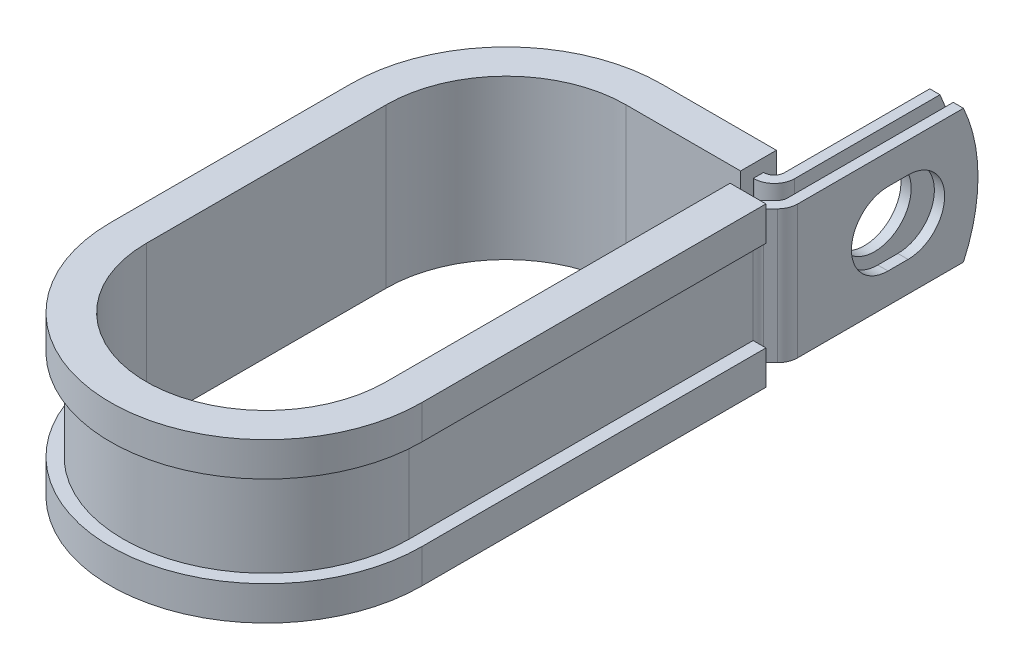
SolidWorks part; units mm, degrees
ref_plane "Front Plane" through (0, 0, 0) normal (0, 0, 1) x (1, 0, 0)
ref_plane "Top Plane" through (0, 0, 0) normal (0, 1, 0) x (1, 0, 0)
ref_plane "Right Plane" through (0, 0, 0) normal (1, 0, 0) x (0, 0, -1)
sketch "Sketch1" plane through (0, 0, 0) normal (0, 1, 0) x (1, 0, 0)
  line L0 (0, 15.8115) -> (13.6958, 15.8115)
  line L1 (15.8115, 0) -> (15.8115, 12.399)
  line L2 (16.1342, 37.2872) -> (16.1342, 18.2499)
  line L3 (16.5257, 14.1232) -> (17.3519, 14.9494)
  line L4 (-15.8115, 0) -> (-15.8115, -28.575)
  line L5 (17.709, 15.8115) -> (17.709, 37.2872)
  line L6 (15.8115, 0) -> (15.8115, -28.575)
  arc A0 (0, 15.8115) -> (-15.8115, 0) centre (0, 0) ccw
  arc A1 (16.5257, 14.1232) -> (15.8115, 12.399) centre (18.2499, 12.399) ccw
  arc A2 (17.3519, 14.9494) -> (17.709, 15.8115) centre (16.4898, 15.8115) ccw
  arc A3 (13.6958, 15.8115) -> (16.1342, 18.2499) centre (13.6958, 18.2499) ccw
  arc A4 (-15.8115, -28.575) -> (15.8115, -28.575) centre (0, -28.575) ccw
extrude "Extrude-Thin1" add sketch "Sketch1" along normal mid plane 15.875 thin
sketch "Sketch2" plane through (14.915, 0, 0) normal (-1, 0, 0) x (0, 0, 1)
  line L0 (-37.2872, 7.9375) -> (-37.2872, -7.9375) construction
  line L1 (0, 7.9375) -> (0, -7.9375) construction
  circle A0 centre (-27.7622, 0) radius 4.3561
  point P2 (-37.2872, 0)
extrude "Cut-Extrude1" cut sketch "Sketch2" against normal up to surface (1.2192 mm away)
sketch "Sketch3" plane through (18.9282, 0, 0) normal (1, 0, 0) x (0, 0, -1)
  line L0 (26.5684, 0) -> (28.956, 0) construction
  line L1 (26.5684, 4.3561) -> (28.956, 4.3561)
  line L2 (26.5684, -4.3561) -> (28.956, -4.3561)
  line L3 (37.2872, 7.9375) -> (37.2872, -7.9375) construction
  arc A0 (26.5684, 4.3561) -> (26.5684, -4.3561) centre (26.5684, 0) ccw
  arc A1 (28.956, -4.3561) -> (28.956, 4.3561) centre (28.956, 0) ccw
  point P3 (27.7622, 0)
  point P8 (37.2872, 0)
  point P11 (22.2123, 0)
  point P12 (33.3121, 0)
extrude "Cut-Extrude2" cut sketch "Sketch3" against normal up to surface (1.2192 mm away)
sketch "Sketch4" plane through (14.915, 0, 0) normal (-1, 0, 0) x (0, 0, 1)
  line L0 (-37.2872, 7.9375) -> (-37.2872, -7.9375)
  line L1 (-37.2872, 7.9375) -> (-35.5548, 7.9375)
  line L2 (-37.2872, 7.9375) -> (-18.2499, 7.9375) construction
  line L3 (-37.2872, -7.9375) -> (-35.5548, -7.9375)
  line L4 (-37.2872, -7.9375) -> (-18.2499, -7.9375) construction
  arc A0 (-35.5548, 7.9375) -> (-35.5548, -7.9375) centre (-18.2372, 0) ccw
extrude "Cut-Extrude3" cut sketch "Sketch4" against normal through all contours A0 M4 M5 | A0 L0 M2
ref_plane "Plane1" through (0, 0, -12.399) normal (0, 0, -1) x (-1, 0, 0)
ref_plane "Plane2" through (13.645, 0, 0) normal (-1, 0, 0) x (0, 0, 1)
sketch "Sketch5" plane through (0, 0, -12.399) normal (0, 0, -1) x (-1, 0, 0)
  line L0 (-17.0307, 7.9375) -> (-15.8115, 7.9375)
  line L1 (-17.0307, 7.9375) -> (-17.0307, -7.9375) construction
  line L3 (-15.8115, 7.9375) -> (-15.8115, -7.9375)
  line L4 (-15.8115, -7.9375) -> (-17.0307, -7.9375)
  line L5 (-17.0307, -7.9375) -> (-17.0307, -5.3975)
  line L6 (-17.0307, 7.9375) -> (-17.0307, 5.3975)
  line L7 (-18.5547, 9.4615) -> (-18.5547, 5.3975)
  line L8 (-18.5547, 9.4615) -> (-14.2875, 9.4615)
  line L9 (-14.2875, 9.4615) -> (-14.2875, -9.4615)
  line L10 (-14.2875, -9.4615) -> (-18.5547, -9.4615)
  line L11 (-18.5547, -9.4615) -> (-18.5547, -5.3975)
  line L12 (-18.5547, 5.3975) -> (-17.0307, 5.3975)
  line L13 (-17.0307, -5.3975) -> (-18.5547, -5.3975)
sketch "Sketch6" plane through (0, 7.9375, 0) normal (0, 1, 0) x (1, 0, 0)
  line L0 (14.2875, 0) -> (14.2875, 12.399)
  line L1 (14.2875, 12.399) -> (18.5547, 12.399) construction
  line L2 (13.645, 6.9878) -> (13.645, -6.9878) construction
  line L3 (14.2875, -28.575) -> (14.2875, 0)
  line L4 (-14.2875, -28.575) -> (-14.2875, 0)
  line L5 (0, 14.2875) -> (13.645, 14.2875)
  arc A0 (0, 14.2875) -> (-14.2875, 0) centre (0, 0) ccw
  arc A1 (-14.2875, -28.575) -> (14.2875, -28.575) centre (0, -28.575) ccw
sweep "Sweep1" add profiles "Sketch5" path "Sketch6"
equation "\"D4@Sketch5\" = \"D1@Extrude-Thin1\""
equation "\"D5@Sketch5\" = \"D5@Extrude-Thin1\""
equation "\"D1@Sketch3\" = \"D2@Sketch2\""
equation "\"D7@Sketch1\" = \"D3@Sketch2\" + \"D1@Sketch3\""
equation "\"D1@Sketch1\" = \"D1@Sketch6\" + 2 * \"D3@Sketch5\""
equation "\"D1@Sketch4\" = ( \"D1@Extrude-Thin1\" + .125 ) * 2"
equation "\"D9@Sketch1\"= \"D5@Extrude-Thin1\""
equation "\"D8@Sketch1\"= 2 * \"D5@Extrude-Thin1\""
equation "\"D2@Sketch1\" = 2 * \"D5@Extrude-Thin1\""
equation "\"D2@Sketch3\" = \"D1@Sketch2\""
equation "\"D6@Sketch1\" = \"D1@Sketch1\""
equation "\"D3@Sketch1\" = \"D1@Sketch6\""
